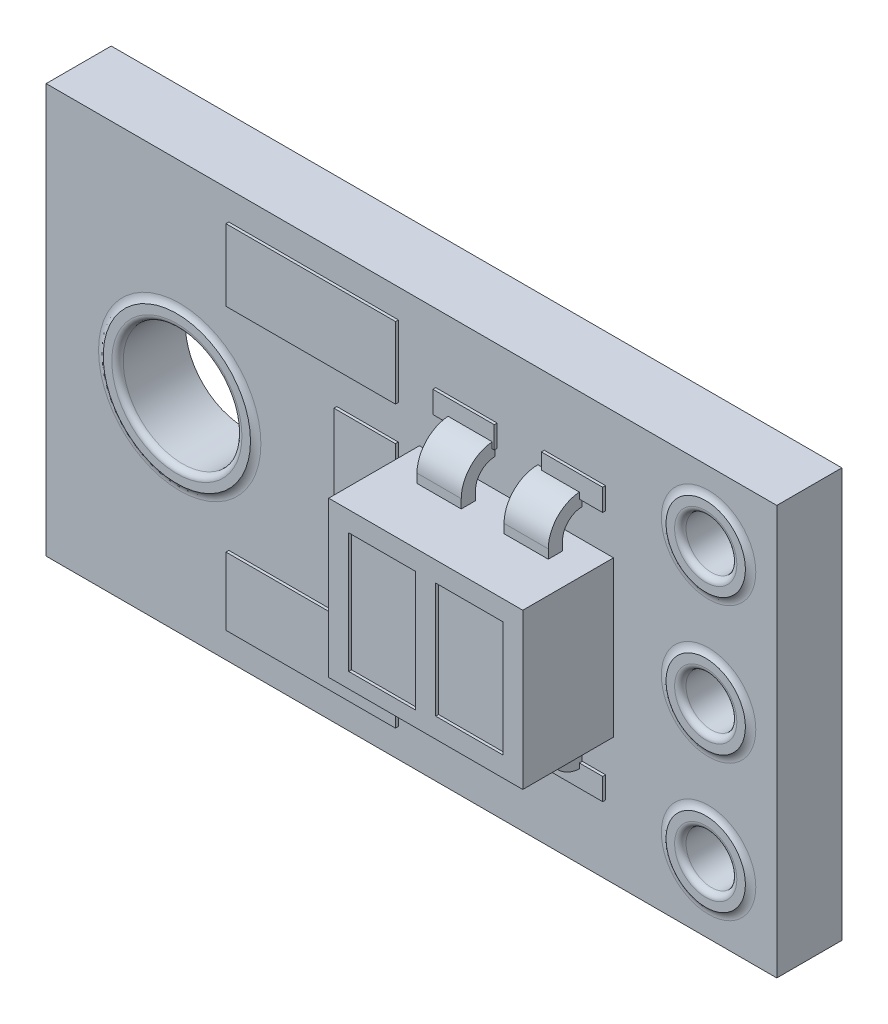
SolidWorks part; units mm, degrees
ref_plane "Front Plane" through (0, 0, 0) normal (0, 0, 1) x (1, 0, 0)
ref_plane "Top Plane" through (0, 0, 0) normal (0, 1, 0) x (1, 0, 0)
ref_plane "Right Plane" through (0, 0, 0) normal (1, 0, 0) x (0, 0, -1)
imported_body "Imported1"
sketch "Sketch1" plane through (0, 0, 0) normal (0, 0, -1) x (-1, 0, 0)
  line L0 (0, 0) -> (-12.8, 0) construction
  line L1 (-10.559, 0) -> (0, 0)
  line L2 (-10.559, 0) -> (-10.559, 2.377)
  line L3 (-10.559, 2.377) -> (0, 2.377)
  line L4 (0, 0) -> (0, 2.377)
  line L5 (0, 7.17) -> (0, 0) construction
extrude "Boss-Extrude1" add sketch "Sketch1" against normal blind 1
